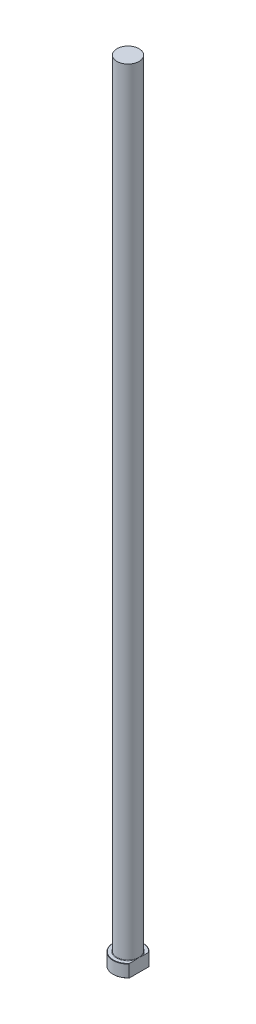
SolidWorks part; units mm, degrees
ref_plane "Front Plane" through (0, 0, 0) normal (0, 0, 1) x (1, 0, 0)
ref_plane "Top Plane" through (0, 0, 0) normal (0, 1, 0) x (1, 0, 0)
ref_plane "Right Plane" through (0, 0, 0) normal (1, 0, 0) x (0, 0, -1)
sketch "Sketch1" plane through (0, 0, 0) normal (0, 0, 1) x (1, 0, 0)
  line L0 (0, 259.9588) -> (0, -15.1925) construction
  line L1 (0, 0) -> (-9.5, 0)
  line L2 (-9.5, 0) -> (-9.5, 8)
  line L3 (-9.5, 8) -> (-7, 8)
  line L4 (-7, 8) -> (-7, 500)
  line L5 (-7, 500) -> (0, 500)
  line L6 (0, 500) -> (0, 0)
  dimension "L" = 500
  dimension "H" = 19
  dimension "T" = 8
  dimension "D" = 14
revolve "Revolve1" add sketch "Sketch1" angle 360 about L0
chamfer "Chamfer1" distance 0.2 angle 45 2 edges at (0, 8, 9.5) (0, 0, 9.5)
fillet "Fillet1" radius 0.3 1 edges at (0, 8, 7)
sketch "Sketch2" plane through (0, 0, 0) normal (0, 1, 0) x (1, 0, 0)
  line L0 (7, -6.4226) -> (7, 6.4226)
  circle A0 centre (0, 0) radius 9.5 construction
  arc A1 (7, -6.4226) -> (7, 6.4226) centre (0, 0) ccw
  circle A2 centre (0, 0) radius 7 construction
extrude "KEYED HEAD" cut sketch "Sketch2" along normal through all
